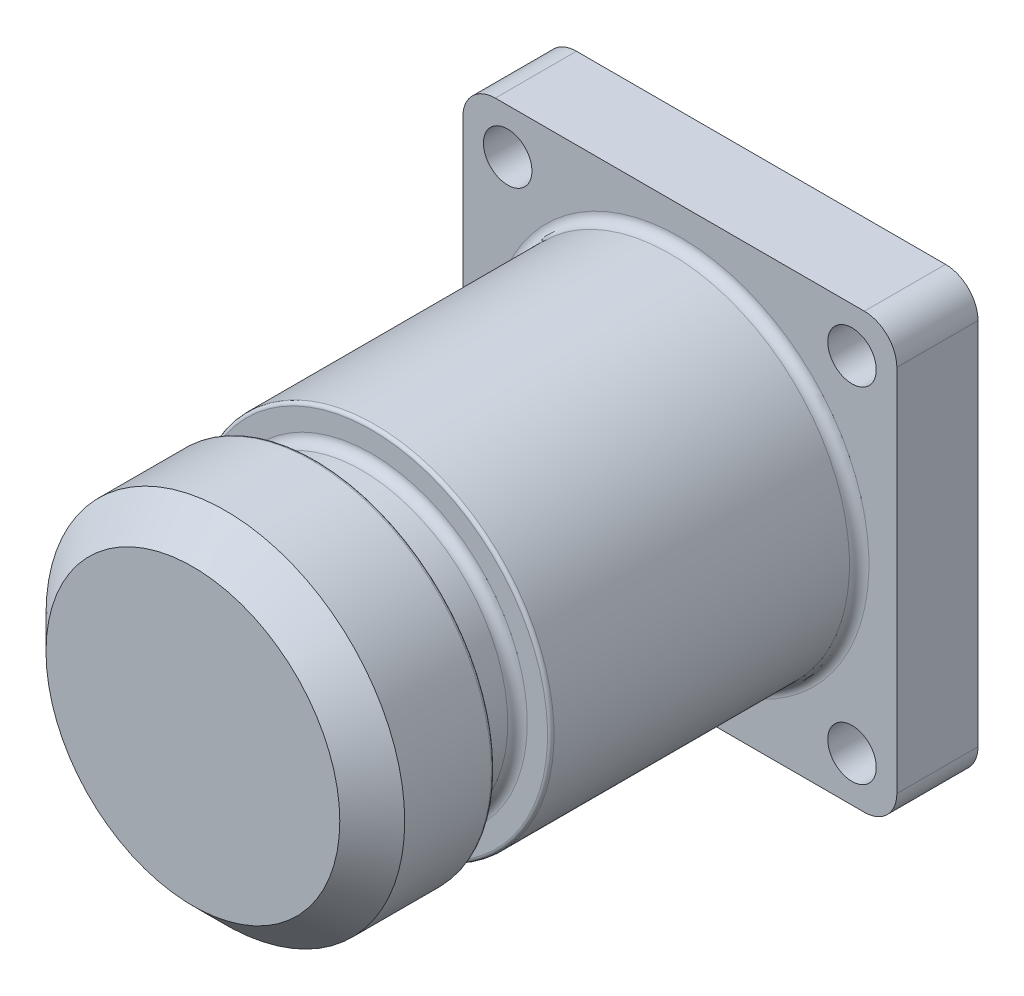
SolidWorks part; units mm, degrees
ref_plane "Front" through (0, 0, 0) normal (0, 0, 1) x (1, 0, 0)
ref_plane "Top" through (0, 0, 0) normal (0, 1, 0) x (1, 0, 0)
ref_plane "Right" through (0, 0, 0) normal (1, 0, 0) x (0, 0, -1)
sketch "Sketch2" plane through (0, 0, 0) normal (1, 0, 0) x (0, 0, -1)
  line L0 (-0.1458, 0) -> (51.1675, 0) construction
  line L1 (0, 14.0335) -> (0, 16.9785)
  line L2 (0, 16.9785) -> (6.35, 16.9785)
  line L3 (6.35, 16.9785) -> (6.35, 0)
  line L7 (-38.1, 14.0335) -> (-28.5242, 14.0335)
  line L8 (-38.1, 0) -> (6.35, 0)
  line L9 (-38.1, 14.0335) -> (-38.1, 0)
  line L10 (-24.13, 14.0335) -> (0, 14.0335)
  line L12 (-28.5242, 14.0335) -> (-28.5242, 11.43)
  line L13 (-28.5242, 11.43) -> (-24.13, 11.43)
  line L14 (-24.13, 14.0335) -> (-24.13, 11.43)
  dimension "D1" = 28.067
  dimension "D2" = 33.957
  dimension "D3" = 24.13
  dimension "D4" = 4.3942
  dimension "D5" = 6.35
  dimension "D6" = 22.86
  dimension "D7" = 38.1
revolve "plug_o-ring_2-118" add sketch "Sketch2" angle 360 about L0
sketch "Sketch3" plane through (0, 0, 0) normal (0, 0, 1) x (1, 0, 0)
  line L1 (-16.9785, 16.9785) -> (16.9785, 16.9785)
  line L2 (-16.9785, 16.9785) -> (-16.9785, -16.9785)
  line L3 (-16.9785, -16.9785) -> (16.9785, -16.9785)
  line L4 (16.9785, 16.9785) -> (16.9785, -16.9785)
  circle A0 centre (0, 0) radius 14.0335
  point P4 (16.9785, 0)
  point P6 (0, 16.9785)
extrude "Boss-Extrude1" add sketch "Sketch3" against normal up to vertex (6.35 mm away)
sketch "Sketch4" plane through (0, 0, -6.35) normal (0, 0, -1) x (-1, 0, 0)
  line L1 (-13.4704, 13.4704) -> (13.4704, 13.4704) construction
  line L2 (-13.4704, 13.4704) -> (-13.4704, -13.4704) construction
  line L3 (-13.4704, -13.4704) -> (13.4704, -13.4704) construction
  line L4 (13.4704, 13.4704) -> (13.4704, -13.4704) construction
  circle A0 centre (0, 0) radius 19.05 construction
  point P0 (-13.4704, 13.4704)
  point P2 (13.4704, 13.4704)
  point P4 (13.4704, -13.4704)
  point P6 (-13.4704, -13.4704)
  dimension "D1" = 38.1
hole_wizard "#6 Clearance Hole1" positions "Sketch4" profile "Sketch5" hole size "#6" standard "ANSI Inch"
sketch "Sketch5" plane through (13.4704, 13.4704, -6.35) normal (1, 0, 0) x (0, 1, 0)
  line L0 (0, 0) -> (0, 44.45)
  line L1 (0, 44.45) -> (1.8986, 44.45)
  line L2 (1.8986, 44.45) -> (1.8986, 0)
  line L5 (1.8986, 0) -> (0, 0)
  line L11 (0, -6.35) -> (0, 107.95) construction
  dimension "Thru Hole Dia." = 3.7973
  dimension "Thru Hole Depth" = 44.45
fillet "Fillet1" radius 2.54 4 edges at (-16.9785, 16.9785, -3.175) (-16.9785, -16.9785, -3.175) (16.9785, -16.9785, -3.175) (16.9785, 16.9785, -3.175)
chamfer "Chamfer1" distance 2.54 angle 45 1 edges at (14.0335, 0, 38.1)
fillet "o-ring_radius" radius 0.762 2 edges at (11.43, 0, 28.5242) (11.43, 0, 24.13)
fillet "o-ring_break_edge" radius 0.254 2 edges at (14.0335, 0, 28.5242) (14.0335, 0, 24.13)
fillet "fillet_max" radius 0.762 1 edges at (14.0335, 0, 0)
